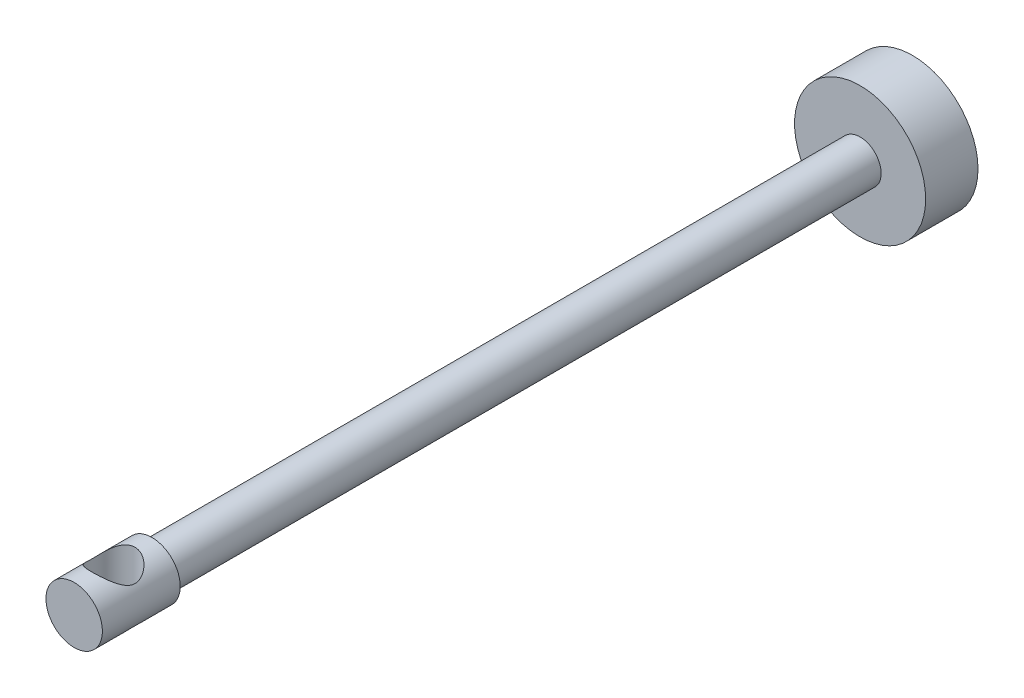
SolidWorks part; units mm, degrees
ref_plane "Front" through (0, 0, 0) normal (0, 0, 1) x (1, 0, 0)
ref_plane "Top" through (0, 0, 0) normal (0, 1, 0) x (1, 0, 0)
ref_plane "Right" through (0, 0, 0) normal (1, 0, 0) x (0, 0, -1)
sketch "Sketch1" plane through (0, 0, 0) normal (0, 0, 1) x (1, 0, 0)
  circle A0 centre (0, 0) radius 7.3152
  dimension "D1" = 14.6304
extrude "Extrude1" add sketch "Sketch1" along normal blind 5.842
sketch "Sketch2" plane through (0, 0, 0) normal (0, 0, 1) x (1, 0, 0)
  circle A0 centre (0, 0) radius 2.3495
  dimension "D1" = 4.699
extrude "Extrude2" add sketch "Sketch2" along normal blind 93.5482
sketch "Sketch3" plane through (0, 0, 93.5482) normal (0, 0, 1) x (1, 0, 0)
  circle A0 centre (0, 0) radius 3.1496
  circle A1 centre (0, 0) radius 2.3495 construction
  dimension "D1" = 6.2992
extrude "Extrude3" add sketch "Sketch3" against normal blind 8.6868
sketch "Sketch4" plane through (0, 0, 0) normal (0, 1, 0) x (1, 0, 0)
  circle A0 centre (0, -89.154) radius 2.4003
  dimension "D2" = 4.8006
  dimension "D1" = 89.154
extrude "Cut-Extrude1" cut sketch "Sketch4" against normal through all and the other way through all
